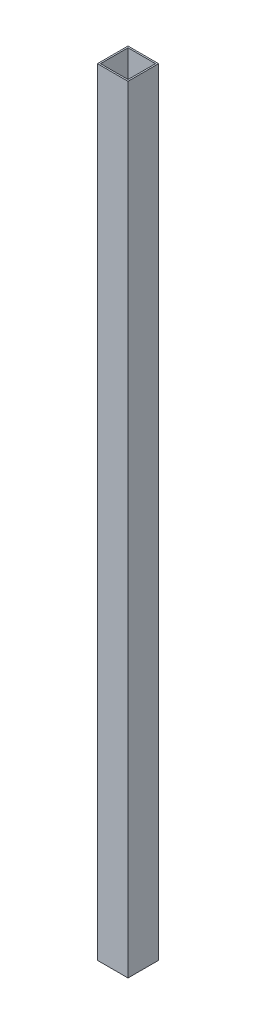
SolidWorks part; units mm, degrees
ref_plane "Front Plane" through (0, 0, 0) normal (0, 0, 1) x (1, 0, 0)
ref_plane "Top Plane" through (0, 0, 0) normal (0, 1, 0) x (1, 0, 0)
ref_plane "Right Plane" through (0, 0, 0) normal (1, 0, 0) x (0, 0, -1)
sketch "Sketch1" plane through (0, 0, 0) normal (0, 1, 0) x (1, 0, 0)
  line L1 (-25, 25) -> (25, 25)
  line L2 (-25, 25) -> (-25, -25)
  line L3 (-25, -25) -> (25, -25)
  line L4 (25, 25) -> (25, -25)
  line L5 (-25, 25) -> (25, -25) construction
  line L6 (-25, -25) -> (25, 25) construction
  point P0 (0, 0)
  dimension "D1" = 50
extrude "Boss-Extrude1" add sketch "Sketch1" along normal blind 1270
shell "Shell1" thickness 2.5
